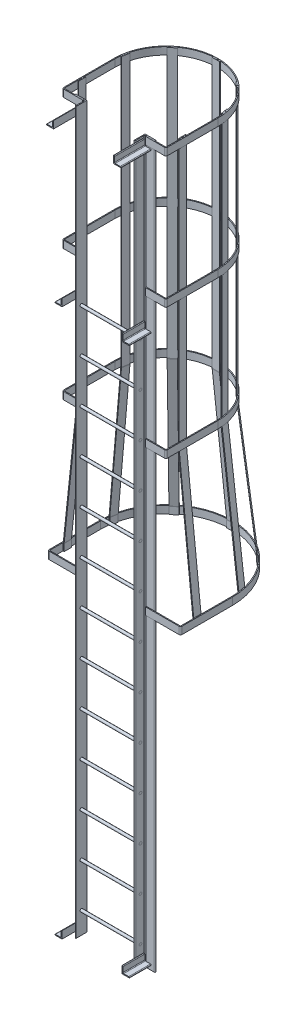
SolidWorks part; units mm, degrees
ref_plane "Front Plane" through (0, 0, 0) normal (0, 0, 1) x (1, 0, 0)
ref_plane "Top Plane" through (0, 0, 0) normal (0, 1, 0) x (1, 0, 0)
ref_plane "Right Plane" through (0, 0, 0) normal (1, 0, 0) x (0, 0, -1)
sketch "LAYOUT" plane through (0, 0, 0) normal (0, 0, 1) x (1, 0, 0)
  line L0 (0, 0) -> (0, 461.6005) construction
  line L1 (-203.2, 0) -> (-203.2, 5029.2)
  line L2 (203.2, 0) -> (203.2, 5029.2)
  line L3 (-457.2, 2133.6) -> (-342.9, 3149.6)
  line L4 (457.2, 2133.6) -> (-457.2, 2133.6)
  line L6 (342.9, 5029.2) -> (-342.9, 5029.2)
  line L7 (457.2, 2133.6) -> (342.9, 3149.6)
  line L8 (-342.9, 3149.6) -> (-342.9, 5029.2)
  line L9 (342.9, 3149.6) -> (342.9, 5029.2)
  line B0 (1527.0985, 3962.4) -> (-1895.4414, 3962.4)
  line B1 (-1895.4414, 3759.2) -> (1527.0985, 3759.2)
  spline B2 degree 3 poles (1527.0985, 3962.4) (1400.5001, 3873.6486) (1710.9465, 3848.3213) (1527.0985, 3759.2) knots 0 0 0 0 1 1 1 1
  spline B3 degree 3 poles (-1895.4414, 3962.4) (-2018.7018, 3875.9827) (-1706.4267, 3847.6682) (-1895.4414, 3759.2) knots 0 0 0 0 1 1 1 1
  dimension "D1" = 914.4
  dimension "D2" = 406.4
  dimension "Platform Height" = 3962.4
  dimension "D4" = 1066.8
  dimension "D5" = 2133.6
  dimension "D6" = 685.8
  dimension "D7" = 1016
  dimension "cage height-straight" = 1879.6
sketch_block_instance "PLATFORM-1"
sketch_block "PLATFORM" parameters "D1"=3422.5399
sketch "layout dims" plane through (0, 0, 0) normal (0, 0, 1) x (1, 0, 0)
  line L0 (0, 3962.4) -> (0, 0)
  line L1 (342.9, 3149.6) -> (342.9, 5003.8)
  line L2 (342.9, 3149.6) -> (342.9, 5029.2) construction
  line L3 (1527.0985, 3962.4) -> (-1895.4414, 3962.4) construction
  line L4 (342.9, 5029.2) -> (-342.9, 5029.2) construction
  dimension "cage height-straight" = 1854.2
  dimension "D2" = 25.4
  dimension "platform height" = 3962.4
other "Structural Member1"
ref_plane "Plane1" through (-203.2, 0, 0) normal (0, 1, 0) x (-1, 0, 0)
sketch "Sketch11" plane through (-203.2, 0, -38.1) normal (0, 1, 0) x (-1, 0, 0)
  line L0 (0, 0) -> (0, 76.2)
  line L1 (0, 76.2) -> (0.0051, 76.2)
  line L2 (6.35, 69.8551) -> (6.35, 14.2875)
  line L3 (14.2875, 6.35) -> (69.8551, 6.35)
  line L4 (76.2, 0.0051) -> (76.2, 0)
  line L5 (76.2, 0) -> (0, 0)
  arc A0 (76.2, 0.0051) -> (69.8551, 6.35) centre (69.8551, 0.0051) ccw
  arc A1 (0.0051, 76.2) -> (6.35, 69.8551) centre (0.0051, 69.8551) cw
  arc A2 (14.2875, 6.35) -> (6.35, 14.2875) centre (14.2875, 14.2875) cw
  circle A3 centre (0, 0) radius 6.35 construction
  point P10 (0, 38.1)
  point P14 (38.1, 0)
  point P15 (0, 0)
  dimension "D2" = 0.0051
  dimension "Radius_1" = 7.9375
  dimension "Radius_2" = 6.35
  dimension "D1" = 6.35
  dimension "V_leg" = 76.2
  dimension "H_leg" = 76.2
  dimension "Thickness" = 6.35
  dimension "Flat_wid" = 0.0051
other "Structural Member2"
ref_plane "Plane2" through (203.2, 0, 0) normal (0, 1, 0) x (-1, 0, 0)
sketch "Sketch12" plane through (203.2, 0, -38.1) normal (0, 1, 0) x (0, 0, 1)
  line L0 (0, 0) -> (0, 76.2)
  line L1 (0, 76.2) -> (0.0051, 76.2)
  line L2 (6.35, 69.8551) -> (6.35, 14.2875)
  line L3 (14.2875, 6.35) -> (69.8551, 6.35)
  line L4 (76.2, 0.0051) -> (76.2, 0)
  line L5 (76.2, 0) -> (0, 0)
  arc A0 (76.2, 0.0051) -> (69.8551, 6.35) centre (69.8551, 0.0051) ccw
  arc A1 (0.0051, 76.2) -> (6.35, 69.8551) centre (0.0051, 69.8551) cw
  arc A2 (14.2875, 6.35) -> (6.35, 14.2875) centre (14.2875, 14.2875) cw
  circle A3 centre (0, 0) radius 6.35 construction
  point P10 (0, 38.1)
  point P14 (38.1, 0)
  point P15 (0, 0)
  dimension "D2" = 0.0051
  dimension "Radius_1" = 7.9375
  dimension "Radius_2" = 6.35
  dimension "D1" = 6.35
  dimension "V_leg" = 76.2
  dimension "H_leg" = 76.2
  dimension "Thickness" = 6.35
  dimension "Flat_wid" = 0.0051
sketch "Sketch27" plane through (209.55, 0, 0) normal (1, 0, 0) x (0, 0, -1)
  line L1 (0, 509.905) -> (0, -509.905) construction
  line L2 (0, 3149.6) -> (0, 5029.2) construction
  line L3 (0, 3810) -> (0, 152.4) construction
  line L4 (0, 3962.4) -> (0, 0) construction
  circle A0 centre (0, 3810) radius 9.525
  point P2 (0, 1981.2)
  dimension "D2" = 19.05
  dimension "D1" = 3657.6
extrude "RUNG HOLES" cut sketch "Sketch27" against normal through all
sketch3d "3DSketch2"
  line L0 (209.55, 3810, 0) -> (-209.55, 3810, 0)
  line L1 (203.2, 3810, 0) -> (209.55, 3810, 0) construction
  line L2 (-209.55, 3810, 0) -> (-203.2, 3810, 0) construction
pattern_linear "RUNG HOLE PATTERN" count 13 spacing 304.8 along (0, -1, 0) of "RUNG HOLES"
other "Structural Member4"
ref_plane "Plane7" through (209.55, 3810, 0) normal (-1, 0, 0) x (0, 0, 1)
sketch "Sketch110" plane through (209.55, 3810, 0) normal (-1, 0, 0) x (0, 0, 1)
  circle A1 centre (0, 0) radius 9.525
  point P3 (0, 0)
  dimension "Out_dia" = 19.05
sketch "Sketch28" plane through (209.55, 0, 0) normal (1, 0, 0) x (0, 0, -1)
  circle A0 centre (0, 3810) radius 9.525 construction
  circle A1 centre (0, 3810) radius 9.525
pattern_linear "RUNG PATTERN" count 13 spacing 304.8 along (0, -1, 0)
ref_plane "Plane3" through (0, 2133.6, 0) normal (0, 1, 0) x (-1, 0, 0)
sketch "Sketch15" plane through (0, 2133.6, 0) normal (0, 1, 0) x (-1, 0, 0)
  line L0 (219.0115, -31.75) -> (454.025, -31.75)
  line L1 (457.2, -34.925) -> (457.2, -387.35)
  line L2 (0, 0) -> (0, -162.0861) construction
  line L3 (-457.2, -34.925) -> (-457.2, -387.35)
  line L4 (-219.0115, -31.75) -> (-454.025, -31.75)
  line L5 (-457.2, -387.35) -> (457.2, -387.35) construction
  line L6 (0, -387.35) -> (429.6275, -543.7216) construction
  line L7 (0, -387.35) -> (228.6, -783.2968) construction
  line L8 (273.0551, -31.75) -> (217.4875, -31.75) construction
  arc A0 (457.2, -387.35) -> (-457.2, -387.35) centre (0, -387.35) cw
  arc A1 (454.025, -31.75) -> (457.2, -34.925) centre (454.025, -34.925) cw
  arc A2 (-457.2, -34.925) -> (-454.025, -31.75) centre (-454.025, -34.925) cw
  point P15 (457.2, -228.6)
  point P16 (429.6275, -543.7216)
  point P20 (-457.2, -228.6)
  point P21 (457.2, -31.75)
  point P25 (-457.2, -31.75)
  dimension "D7" = 3.175
  dimension "D1" = 355.6
  dimension "D2" = 196.85
  dimension "D3" = 20
  dimension "D4" = 40
  dimension "D5" = 1.524
  dimension "D6" = 914.4
other "Structural Member5"
ref_plane "Plane8" through (219.0115, 2133.6, -31.75) normal (1, 0, 0) x (0, 0, -1)
sketch "Plate" plane through (219.0115, 2159, -25.4) normal (1, 0, 0) x (0, -1, 0)
  line L0 (0, 6.35) -> (0, 0) construction
  line L1 (-25.4, 0) -> (25.4, 0)
  line L2 (-25.4, 0) -> (-25.4, 6.35)
  line L3 (-25.4, 6.35) -> (25.4, 6.35)
  line L4 (25.4, 0) -> (25.4, 6.35)
  point P4 (0, 0)
  point P7 (0, 3.175)
  dimension "D1" = 6.35
  dimension "D2" = 50.8
ref_plane "Plane6" through (0, 3149.6, 0) normal (0, 1, 0) x (-1, 0, 0)
sketch "Sketch31" plane through (0, 3149.6, 0) normal (0, 1, 0) x (-1, 0, 0)
  line L1 (273.0551, -31.75) -> (217.4875, -31.75) construction
  line L22 (219.075, -31.75) -> (352.425, -31.75)
  line L23 (355.6, -34.925) -> (355.6, -387.35)
  line L24 (-355.6, -387.35) -> (-355.6, -34.925)
  line L25 (-352.425, -31.75) -> (-219.075, -31.75)
  arc A0 (352.425, -31.75) -> (355.6, -34.925) centre (352.425, -34.925) cw
  arc A1 (-355.6, -34.925) -> (-352.425, -31.75) centre (-352.425, -34.925) cw
  arc A4 (-355.6, -387.35) -> (355.6, -387.35) centre (0, -387.35) ccw
  point P12 (355.6, -31.75)
  point P17 (-355.6, -31.75)
  dimension "D1" = 355.6
  dimension "D4" = 355.6
  dimension "D3" = 3.175
  dimension "D2" = 1.5875
other "Structural Member6"
ref_plane "Plane9" through (-219.075, 3149.6, -31.75) normal (-1, 0, 0) x (0, 0, 1)
sketch "Plate1" plane through (-219.075, 3175, -31.75) normal (-1, 0, 0) x (0, -1, 0)
  line L0 (0, 6.35) -> (0, 0) construction
  line L1 (-25.4, 0) -> (25.4, 0)
  line L2 (-25.4, 0) -> (-25.4, 6.35)
  line L3 (-25.4, 6.35) -> (25.4, 6.35)
  line L4 (25.4, 0) -> (25.4, 6.35)
  point P4 (0, 0)
  point P7 (0, 3.175)
  dimension "D1" = 6.35
  dimension "D2" = 50.8
pattern_curve "cage hoops" parameters "number of"=3, "D3"=50, "D2"=1, "D4"=50
sketch "Sketch32" plane through (0, 2133.6, 0) normal (0, 1, 0) x (-1, 0, 0)
  line L2 (455.4642, -31.75) -> (455.93, -387.35) construction
  line L4 (-219.0115, -31.75) -> (-454.025, -31.75) construction
  line L6 (0, 0) -> (0, -843.28) construction
  line L7 (-457.2, 0) -> (457.2, 0) construction
  line L9 (-457.2, -387.35) -> (457.2, -387.35) construction
  line L10 (219.0115, -31.75) -> (454.025, -31.75) construction
  arc A0 (-457.2, -387.35) -> (457.2, -387.35) centre (0, -387.35) ccw construction
  arc A1 (0, -843.28) -> (455.93, -387.35) centre (0.5964, -387.9464) ccw construction
  spline S0 degree 3 poles (0, -843.28) (247.999, -843.6048) (431.32, -676.5808) (454.0191, -429.6226) (454.4494, -424.9406) (455.1651, -415.5632) (455.9485, -401.4552) (455.9362, -392.0517) (455.93, -387.35) (455.9239, -382.6768) (455.9116, -373.3305) (455.8933, -359.3109) (455.881, -349.9646) (455.8749, -345.2914) (455.738, -240.7776) (455.6011, -136.2638) (455.4642, -31.75) knots 0 0 0 0 0.606849 0.606849 0.606849 0.620785 0.634721 0.648658 0.648658 0.648658 0.662509 0.676361 0.690213 0.690213 0.690213 1 1 1 1 weights 1 0.825545 0.825545 1 1 1 1 1 1 1 1 1 1 1 1 1 1
  point P3 (0, -843.28)
  point P13 (292.8223, -737.1356)
  point P14 (448.9089, -467.6016)
  dimension "D1" = 1.27
  dimension "D3" = 40
  dimension "D4" = 40
  dimension "D7" = 1.27
sketch "Sketch33" plane through (0, 2133.6, -736.6) normal (-1, 0, 0) x (0, 0, 1)
  line L0 (-106.5404, 52.1258) -> (-5.2196, 1014.6742)
  line L1 (-5.08, 1017.3332) -> (-5.08, 2895.6)
  line L2 (-106.68, 49.4668) -> (-106.68, 0)
  line L3 (1127.76, 1016) -> (345.44, 1016) construction
  line L4 (-6.35, 1066.8) -> (-6.35, 1016) construction
  line L8 (-5.08, 2895.6) -> (736.6, 2895.6) construction
  arc A0 (-5.2196, 1014.6742) -> (-5.08, 1017.3332) centre (-30.48, 1017.3332) ccw
  arc A1 (-106.5404, 52.1258) -> (-106.68, 49.4668) centre (-81.28, 49.4668) ccw
  point P9 (-5.08, 1016)
  point P16 (-106.68, 50.8)
  dimension "D3" = 25.4
  dimension "D1" = 50.8
  dimension "D2" = 1.27
other "Structural Member7"
ref_plane "Plane10" through (0, 2183.0668, -843.28) normal (0, 1, 0) x (0, 0, 1)
sketch "Plate2" plane through (0, 2183.0668, -843.28) normal (0, 1, 0) x (-1, 0, 0)
  line L0 (0, 6.35) -> (0, 0) construction
  line L1 (-25.4, 0) -> (25.4, 0)
  line L2 (-25.4, 0) -> (-25.4, 6.35)
  line L3 (-25.4, 6.35) -> (25.4, 6.35)
  line L4 (25.4, 0) -> (25.4, 6.35)
  point P4 (0, 0)
  point P7 (0, 3.175)
  dimension "D1" = 6.35
  dimension "D2" = 50.8
pattern_curve "CrvPattern2" parameters "D1"=4, "D3"=317.5, "D2"=1, "D4"=6.35
mirror "Mirror2" about plane through (0, 0, 0) normal (1, 0, 0)
sketch "Sketch29" plane through (-209.55, 0, 0) normal (-1, 0, 0) x (0, 0, 1)
  line L0 (-23.8125, 3860.8) -> (128.5875, 3860.8)
  line L1 (-23.8125, 5029.2) -> (-23.8125, 0) construction
  line L2 (-23.8125, 38.1) -> (128.5875, 38.1)
  line L3 (-23.8125, 5029.2) -> (31.7551, 5029.2) construction
  dimension "D1" = 152.4
  dimension "D2" = 152.4
  dimension "D3" = 38.1
  dimension "D4" = 1168.4
other "Structural Member3"
ref_plane "Plane5" through (-209.55, 38.1, -23.8125) normal (0, 0, 1) x (0, 1, 0)
sketch "Sketch19" plane through (-209.55, 38.1, -23.8125) normal (0, 0, 1) x (0, 1, 0)
  line L0 (0, 0) -> (0, 50.8)
  line L1 (0, 50.8) -> (1.5926, 50.8)
  line L2 (6.35, 46.0426) -> (6.35, 11.1125)
  line L3 (11.1125, 6.35) -> (46.0426, 6.35)
  line L4 (50.8, 1.5926) -> (50.8, 0)
  line L5 (50.8, 0) -> (0, 0)
  arc A0 (50.8, 1.5926) -> (46.0426, 6.35) centre (46.0426, 1.5926) ccw
  arc A1 (1.5926, 50.8) -> (6.35, 46.0426) centre (1.5926, 46.0426) cw
  arc A2 (11.1125, 6.35) -> (6.35, 11.1125) centre (11.1125, 11.1125) cw
  circle A3 centre (0, 0) radius 4.7625 construction
  point P10 (0, 25.4)
  point P14 (25.4, 0)
  point P15 (0, 0)
  dimension "D2" = 1.5926
  dimension "Radius_1" = 4.7625
  dimension "Radius_2" = 4.7625
  dimension "D1" = 6.35
  dimension "V_leg" = 50.8
  dimension "H_leg" = 50.8
  dimension "Thickness" = 6.35
  dimension "Flat_wid" = 1.5926
mirror "Mirror1" about plane through (0, 0, 0) normal (1, 0, 0)
pattern_linear "LPattern9" count 2 spacing 1104.9 along (0, 1, 0)
sketch "Sketch30" plane through (0, 0, 128.5875) normal (0, 0, 1) x (1, 0, 0)
  line L6 (209.55, 5016.5) -> (209.55, 4965.7)
  line L7 (209.55, 4965.7) -> (260.35, 4965.7)
  line L8 (260.35, 4965.7) -> (260.35, 4967.2926)
  line L9 (255.5926, 4972.05) -> (220.6625, 4972.05)
  line L10 (215.9, 4976.8125) -> (215.9, 5011.7426)
  line L11 (211.1426, 5016.5) -> (209.55, 5016.5)
  line L12 (209.55, 5016.5) -> (209.55, 4965.7)
  line L13 (209.55, 4965.7) -> (260.35, 4965.7)
  line L14 (260.35, 4965.7) -> (260.35, 4967.2926)
  line L15 (255.5926, 4972.05) -> (220.6625, 4972.05)
  line L16 (215.9, 4976.8125) -> (215.9, 5011.7426)
  line L17 (211.1426, 5016.5) -> (209.55, 5016.5)
  line L18 (-209.55, 4965.7) -> (-209.55, 5016.5)
  line L19 (-209.55, 5016.5) -> (-211.1426, 5016.5)
  line L20 (-215.9, 5011.7426) -> (-215.9, 4976.8125)
  line L21 (-220.6625, 4972.05) -> (-255.5926, 4972.05)
  line L22 (-260.35, 4967.2926) -> (-260.35, 4965.7)
  line L23 (-260.35, 4965.7) -> (-209.55, 4965.7)
  line L24 (-209.55, 4965.7) -> (-209.55, 5016.5)
  line L25 (-209.55, 5016.5) -> (-211.1426, 5016.5)
  line L26 (-215.9, 5011.7426) -> (-215.9, 4976.8125)
  line L27 (-220.6625, 4972.05) -> (-255.5926, 4972.05)
  line L28 (-260.35, 4967.2926) -> (-260.35, 4965.7)
  line L29 (-260.35, 4965.7) -> (-209.55, 4965.7)
  arc A3 (260.35, 4967.2926) -> (255.5926, 4972.05) centre (255.5926, 4967.2926) ccw
  arc A4 (215.9, 4976.8125) -> (220.6625, 4972.05) centre (220.6625, 4976.8125) ccw
  arc A5 (215.9, 5011.7426) -> (211.1426, 5016.5) centre (211.1426, 5011.7426) ccw
  arc A6 (260.35, 4967.2926) -> (255.5926, 4972.05) centre (255.5926, 4967.2926) ccw
  arc A7 (215.9, 4976.8125) -> (220.6625, 4972.05) centre (220.6625, 4976.8125) ccw
  arc A8 (215.9, 5011.7426) -> (211.1426, 5016.5) centre (211.1426, 5011.7426) ccw
  arc A9 (-211.1426, 5016.5) -> (-215.9, 5011.7426) centre (-211.1426, 5011.7426) ccw
  arc A10 (-220.6625, 4972.05) -> (-215.9, 4976.8125) centre (-220.6625, 4976.8125) ccw
  arc A11 (-255.5926, 4972.05) -> (-260.35, 4967.2926) centre (-255.5926, 4967.2926) ccw
  arc A12 (-211.1426, 5016.5) -> (-215.9, 5011.7426) centre (-211.1426, 5011.7426) ccw
  arc A13 (-220.6625, 4972.05) -> (-215.9, 4976.8125) centre (-220.6625, 4976.8125) ccw
  arc A14 (-255.5926, 4972.05) -> (-260.35, 4967.2926) centre (-255.5926, 4967.2926) ccw
  dimension "D1" = 0
  dimension "D2" = 0
extrude "Extrude4" add sketch "Sketch30" along normal blind 58.928
equation "\"number of@cage hoops\" =  int( \"cage height-straight@LAYOUT\"/44)+2"
equation "\"D1@RUNG HOLE PATTERN\" = int( \"Platform Height@LAYOUT\"-6)/12"
equation "\"D1@RUNG PATTERN\" = \"D1@RUNG HOLE PATTERN\" "
equation "\"D1@Sketch27\" = (int(\"Platform Height@LAYOUT\"/12)-1)*12"
